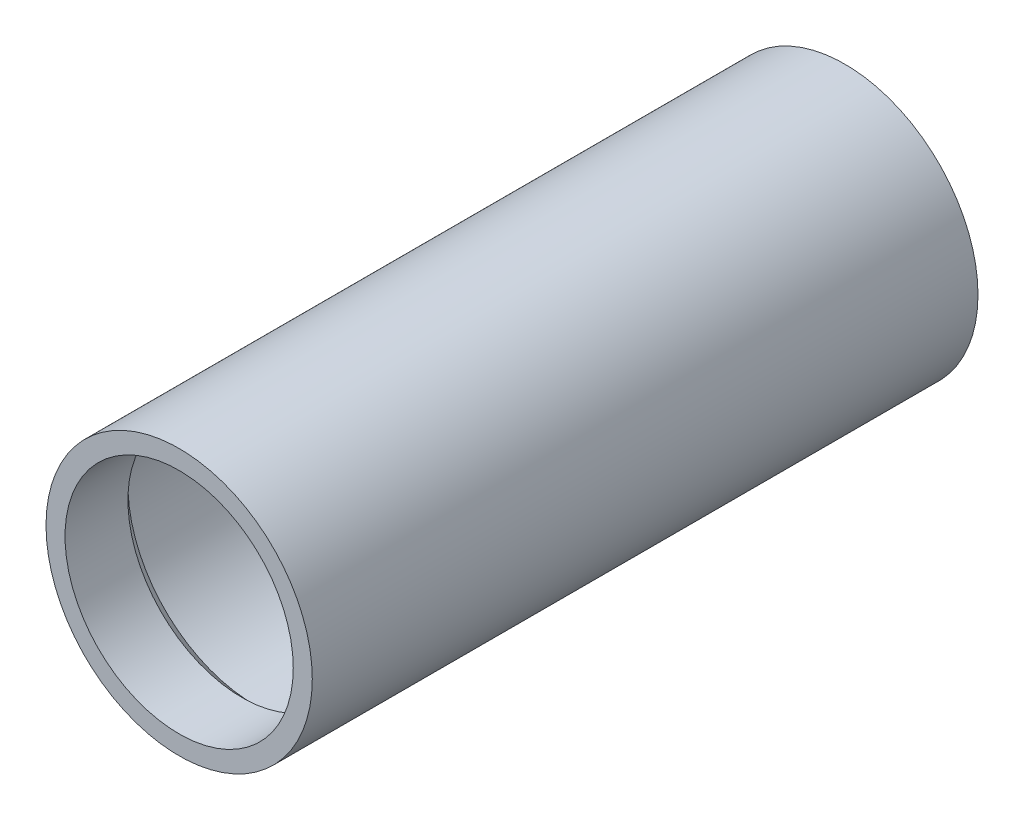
SolidWorks part; units mm, degrees
ref_plane "Front Plane" through (0, 0, 0) normal (0, 0, 1) x (1, 0, 0)
ref_plane "Top Plane" through (0, 0, 0) normal (0, 1, 0) x (1, 0, 0)
ref_plane "Right Plane" through (0, 0, 0) normal (1, 0, 0) x (0, 0, -1)
sketch "Sketch1" plane through (0, 0, 0) normal (1, 0, 0) x (0, 0, -1)
  line L0 (0, 0) -> (38618.5249, 0) construction
  line L1 (0, 44.45) -> (222.25, 44.45)
  line L2 (222.25, 44.45) -> (222.25, 38.1)
  line L3 (222.25, 38.1) -> (201.25, 38.1)
  line L4 (201.25, 38.1) -> (196.9, 42.45)
  line L5 (196.9, 42.45) -> (25.35, 42.45)
  line L6 (25.35, 42.45) -> (21, 38.1)
  line L7 (21, 38.1) -> (0, 38.1)
  line L8 (0, 38.1) -> (0, 44.45)
  dimension "D1" = 88.9
  dimension "D2" = 76.2
  dimension "D3" = 222.25
  dimension "D4" = 21
  dimension "D5" = 135
  dimension "D6" = 2
revolve "Revolve1" add sketch "Sketch1" angle 360 about L0
